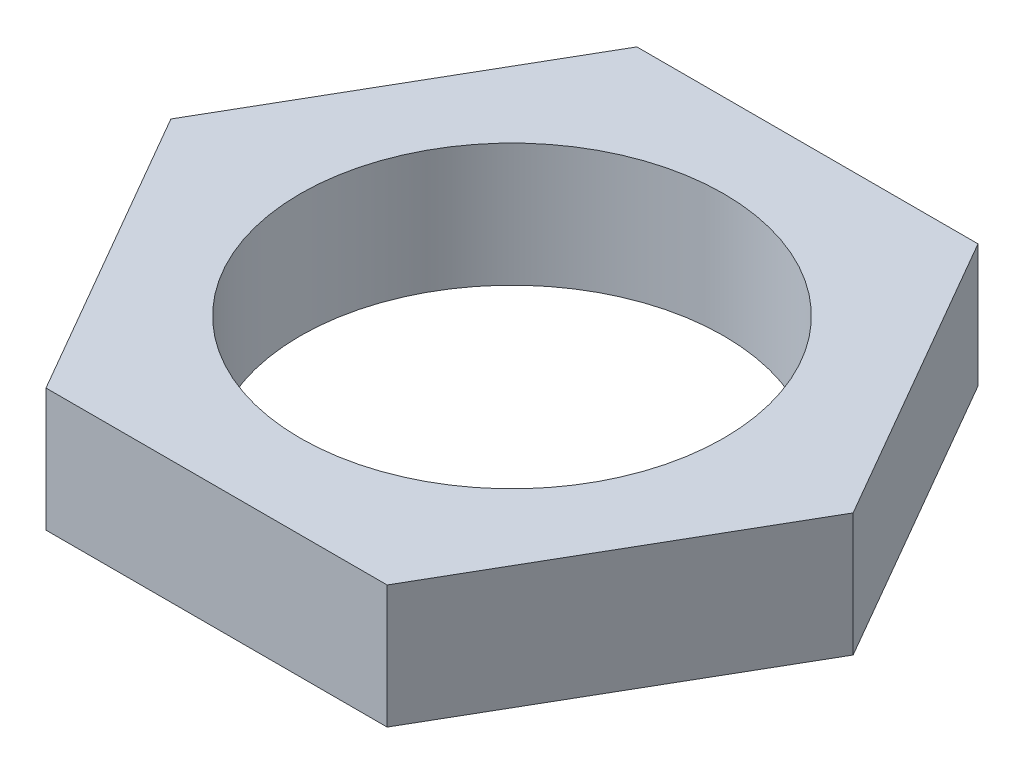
SolidWorks part; units mm, degrees
ref_plane "Plan de face" through (0, 0, 0) normal (0, 0, 1) x (1, 0, 0)
ref_plane "Plan de dessus" through (0, 0, 0) normal (0, 1, 0) x (1, 0, 0)
ref_plane "Plan de droite" through (0, 0, 0) normal (1, 0, 0) x (0, 0, -1)
sketch "Esquisse1" plane through (0, 0, 0) normal (0, 1, 0) x (1, 0, 0)
  line L1 (6.9282, -12) -> (13.8564, 0)
  line L2 (13.8564, 0) -> (6.9282, 12)
  line L3 (6.9282, 12) -> (-6.9282, 12)
  line L4 (-6.9282, 12) -> (-13.8564, 0)
  line L5 (-13.8564, 0) -> (-6.9282, -12)
  line L6 (-6.9282, -12) -> (6.9282, -12)
  circle A0 centre (0, 0) radius 12 construction
  circle A1 centre (0, 0) radius 8.6
  dimension "D2" = 17.2
  dimension "D1" = 24
extrude "Extrusion1" add sketch "Esquisse1" along normal blind 5
